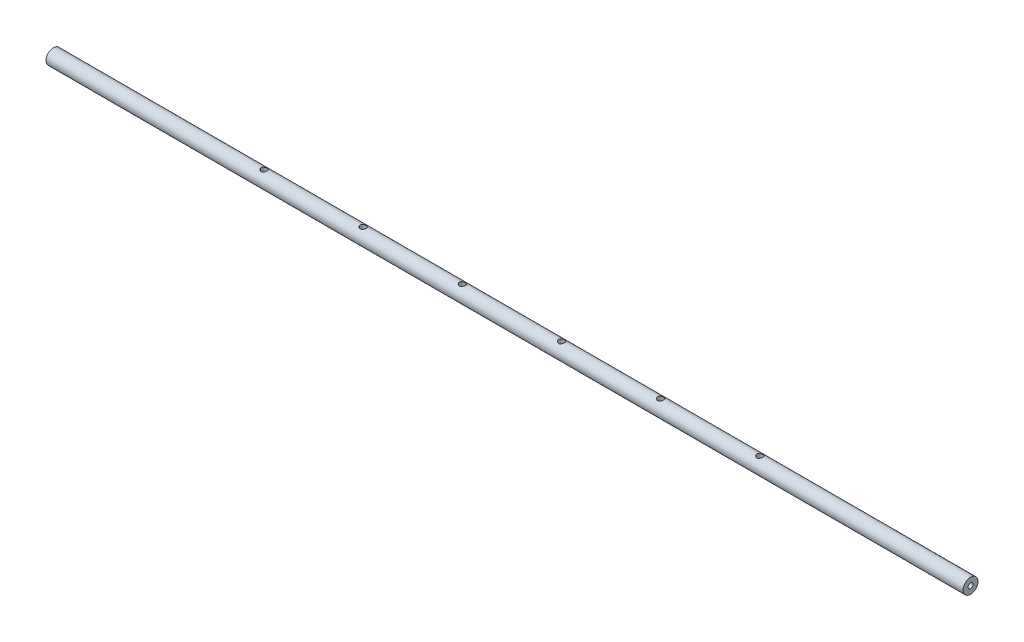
SolidWorks part; units mm, degrees
ref_plane "Plan de face" through (0, 0, 0) normal (0, 0, 1) x (1, 0, 0)
ref_plane "Plan de dessus" through (0, 0, 0) normal (0, 1, 0) x (1, 0, 0)
ref_plane "Plan de droite" through (0, 0, 0) normal (1, 0, 0) x (0, 0, -1)
sketch "Esquisse2" plane through (0, 0, 0) normal (1, 0, 0) x (0, 0, -1)
  circle A0 centre (0, 0) radius 7.5
  dimension "D1" = 15
extrude "Extrusion1" add sketch "Esquisse2" along normal mid plane 925
hole_wizard "Trou taraudé M6x1.01" positions "Esquisse4" profile "Esquisse3" tap size "M6x1.0" standard "ISO"
sketch "Esquisse4" plane through (-462.5, 0, 0) normal (-1, 0, 0) x (0, 0, 1)
  point P0 (0, 0)
sketch "Esquisse3" plane through (-462.5, 0, 0) normal (0, 1, 0) x (0, 0, 1)
  line L0 (0, 0) -> (0, 24.5022)
  line L1 (0, 24.5022) -> (2.5, 23)
  line L2 (2.5, 23) -> (2.5, 0)
  line L5 (2.5, 0) -> (0, 0)
  line L10 (0, 24.5022) -> (-2.5, 23) construction
  line L11 (0, -6.35) -> (0, 107.95) construction
  dimension "Diamètre du trou pour taraudage" = 5
  dimension "Profondeur du trou pour taraudage" = 23
  dimension "Angle de pointe" = 118
hole_wizard "Trou taraudé M6x1.02" positions "Esquisse6" profile "Esquisse5" tap size "M6x1.0" standard "ISO"
sketch "Esquisse6" plane through (462.5, 0, 0) normal (1, 0, 0) x (0, 0, -1)
  point P0 (0, 0)
sketch "Esquisse5" plane through (462.5, 0, 0) normal (0, 1, 0) x (0, 0, -1)
  line L0 (0, 0) -> (0, 24.5022)
  line L1 (0, 24.5022) -> (2.5, 23)
  line L2 (2.5, 23) -> (2.5, 0)
  line L5 (2.5, 0) -> (0, 0)
  line L10 (0, 24.5022) -> (-2.5, 23) construction
  line L11 (0, -6.35) -> (0, 107.95) construction
  dimension "Diamètre du trou pour taraudage" = 5
  dimension "Profondeur du trou pour taraudage" = 23
  dimension "Angle de pointe" = 118
sketch "Esquisse7" plane through (0, 0, 0) normal (0, 1, 0) x (1, 0, 0)
  line L0 (-462.5, 7.5) -> (-462.5, -7.5) construction
  line L1 (462.5, 0) -> (-462.5, 0) construction
  circle A0 centre (-250, 0) radius 3
  dimension "D2" = 6
  dimension "D1" = 212.5
extrude "Enlèv. mat.-Extru.1" cut sketch "Esquisse7" against normal mid plane 20
pattern_linear "Répétition linéaire1" count 6 spacing 100 along (1, 0, 0) of "Enlèv. mat.-Extru.1"
